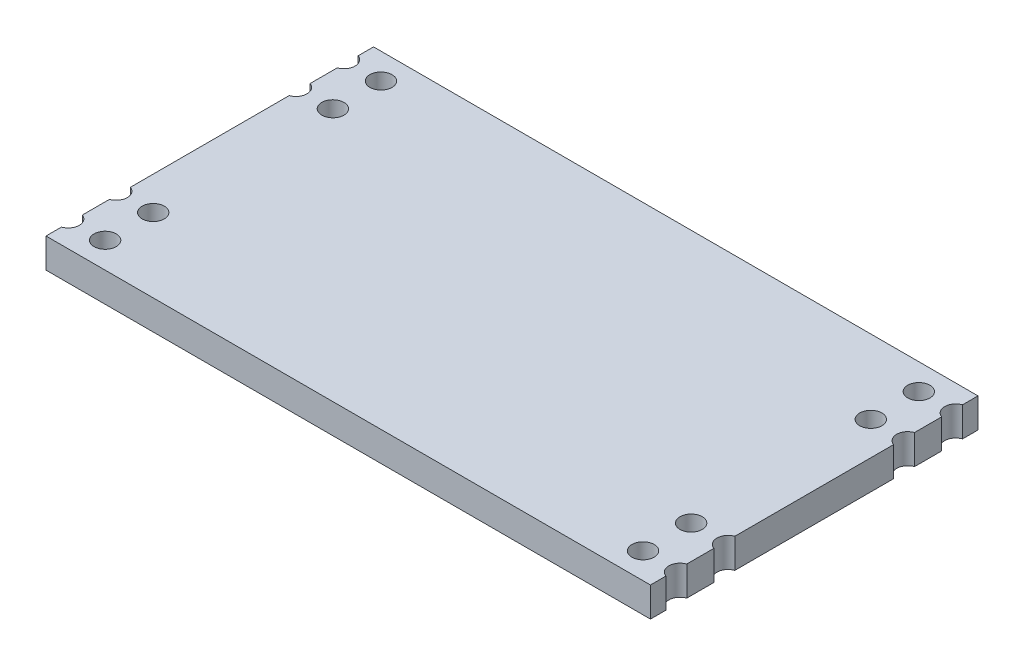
SolidWorks part; units mm, degrees
ref_plane "Front Plane" through (0, 0, 0) normal (0, 0, 1) x (1, 0, 0)
ref_plane "Top Plane" through (0, 0, 0) normal (0, 1, 0) x (1, 0, 0)
ref_plane "Right Plane" through (0, 0, 0) normal (1, 0, 0) x (0, 0, -1)
sketch "Sketch1" plane through (0, 0, 0) normal (0, 1, 0) x (1, 0, 0)
  line L1 (-16.35, 8.86) -> (16.35, 8.86)
  line L2 (-16.35, 8.86) -> (-16.35, -8.86)
  line L3 (-16.35, -8.86) -> (16.35, -8.86)
  line L4 (16.35, 8.86) -> (16.35, -8.86)
  line L5 (-16.35, 8.86) -> (16.35, -8.86) construction
  line L6 (-16.35, -8.86) -> (16.35, 8.86) construction
  point P0 (0, 0)
  dimension "D1" = 17.72
  dimension "D2" = 32.7
extrude "MAIN BODY" add sketch "Sketch1" along normal blind 1.6
sketch "Sketch2" plane through (0, 1.6, 0) normal (0, 1, 0) x (1, 0, 0)
  line L0 (-14.55, 7.46) -> (-14.55, 4.86) construction
  line L1 (16.35, 8.86) -> (-16.35, 8.86) construction
  line L2 (-16.35, 8.86) -> (-16.35, -8.86) construction
  circle A0 centre (-14.55, 7.46) radius 0.6
  circle A1 centre (-14.55, 4.86) radius 0.6
  dimension "D1" = 1.2
  dimension "D2" = 2.6
  dimension "D3" = 1.4
  dimension "D4" = 1.8
extrude "SOLDERED CONNECTION HOLES" cut sketch "Sketch2" against normal through all
pattern_linear "LPattern1" count 2 spacing 2 along (-1, 0, 0) of "SOLDERED CONNECTION HOLES"
mirror "Mirror1" about plane through (0, 0, 0) normal (1, 0, 0) of "LPattern1", "SOLDERED CONNECTION HOLES"
mirror "Mirror2" about plane through (0, 0, 0) normal (0, 0, 1) of "LPattern1", "SOLDERED CONNECTION HOLES", "Mirror1"
